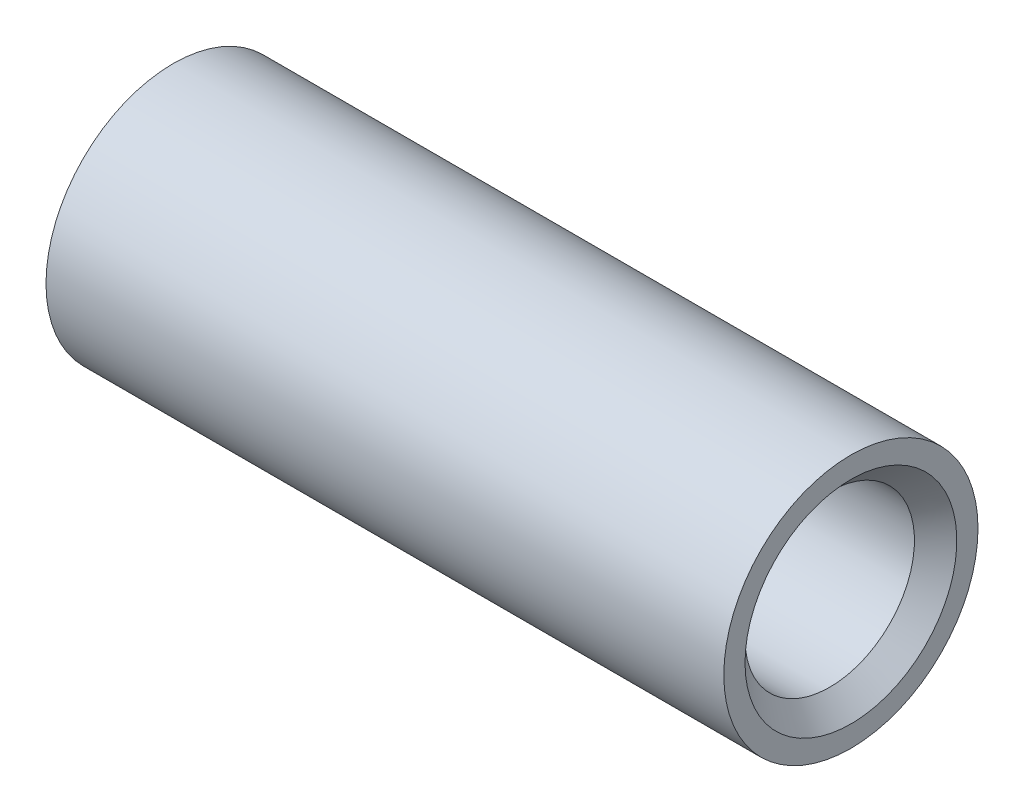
SolidWorks part; units mm, degrees
ref_plane "Plan de face" through (0, 0, 0) normal (0, 0, 1) x (1, 0, 0)
ref_plane "Plan de dessus" through (0, 0, 0) normal (0, 1, 0) x (1, 0, 0)
ref_plane "Plan de droite" through (0, 0, 0) normal (1, 0, 0) x (0, 0, -1)
sketch "Esquisse1" plane through (0, 0, 0) normal (0, 0, 1) x (1, 0, 0)
  line L0 (-63.7762, 0) -> (73.1892, 0) construction
  line L1 (0, 35.2553) -> (0, -12.7918) construction
  line L2 (-16, 4) -> (16, 4)
  line L3 (-16, 4) -> (-16, 6)
  line L4 (-16, 6) -> (16, 6)
  line L5 (16, 4) -> (16, 6)
  dimension "D1" = 8
  dimension "D2" = 32
  dimension "D3" = 12
revolve "Révolution1" add sketch "Esquisse1" angle 360 about L0
chamfer "Chanfrein1" distance 1 angle 45 2 edges at (16, 0, 4) (-16, 0, 4)
